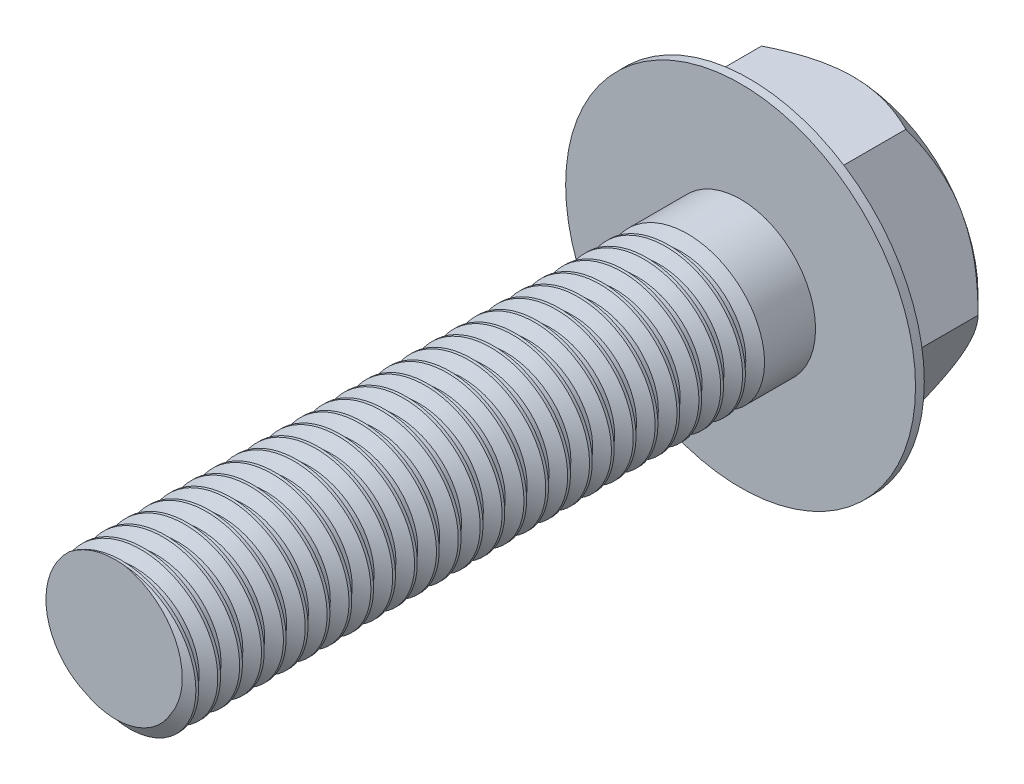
SolidWorks part; units mm, degrees
ref_plane "Front Plane" through (0, 0, 0) normal (0, 0, 1) x (1, 0, 0)
ref_plane "Top Plane" through (0, 0, 0) normal (0, 1, 0) x (1, 0, 0)
ref_plane "Right Plane" through (0, 0, 0) normal (1, 0, 0) x (0, 0, -1)
sketch "Sketch1" plane through (0, 0, 0) normal (0, 0, 1) x (1, 0, 0)
  line L1 (5.7735, -10) -> (11.547, 0)
  line L2 (11.547, 0) -> (5.7735, 10)
  line L3 (5.7735, 10) -> (-5.7735, 10)
  line L4 (-5.7735, 10) -> (-11.547, 0)
  line L5 (-11.547, 0) -> (-5.7735, -10)
  line L6 (-5.7735, -10) -> (5.7735, -10)
  circle A0 centre (0, 0) radius 10 construction
  dimension "D1" = 20
extrude "Boss-Extrude1" add sketch "Sketch1" along normal blind 8
sketch "Sketch3" plane through (0, 0, 0) normal (0, 1, 0) x (1, 0, 0)
  line L0 (0, 0) -> (0, -8) construction
  line L1 (5.7735, -8) -> (-5.7735, -8) construction
  line L2 (0, -7.5) -> (9.4789, -7.5)
  line L4 (9.4789, -7.5) -> (14, -8.2972)
  line L5 (14, -8.2972) -> (14, -9)
  line L6 (14, -9) -> (0, -9)
  line L7 (0, -9) -> (0, -7.5)
  dimension "D1" = 1.5
  dimension "D2" = 10
  dimension "D3" = 14
  dimension "D4" = 7.5
revolve "Revolve1" add sketch "Sketch3" angle 360 about L0
sketch "Sketch2" plane through (0, 0, 9) normal (0, 0, 1) x (1, 0, 0)
  circle A0 centre (0, 0) radius 6
  dimension "D1" = 12
extrude "Boss-Extrude2" add sketch "Sketch2" along normal blind 50
sketch "Sketch4" plane through (0, 0, 0) normal (0, 0, -1) x (-1, 0, 0)
  line L0 (5.7735, -10) -> (11.547, 0) construction
  circle A0 centre (0, 0) radius 10
extrude "Cut-Extrude1" cut sketch "Sketch4" against normal blind 10 draft 45 flip side to cut
thread "Thread1" pitch 1.75 start angle 0, offset 2, length 47, pitch 1.75, diameter 12
ref_plane "Plane1" through (-6, 0, 61) normal (0, -1, 0) x (-1, 0, 0)
sketch "Thread Profile1" plane through (-6, 0, 61) normal (0, -1, 0) x (-1, 0, 0)
  line L0 (0, 0) -> (0, 1.75) construction
  line L11 (0, 0) -> (0, 1.5312)
  line L12 (0, 1.5312) -> (-0.9472, 0.9844)
  line L13 (-0.9472, 0.9844) -> (-0.9472, 0.5469)
  line L15 (-0.9472, 0.5469) -> (0, 0)
  line L17 (-0.9472, 0.7656) -> (0, 0.7656) construction
  point P2 (0, 0)
  dimension "Pitch" = 1.75
  dimension "Profile_Angle" = 60
  dimension "Profile_Land" = 0.4375
  dimension "Profile_Height" = 0.9472
scale "Scale1" scale about centroid uniform scaling yes scale factor 0.42
